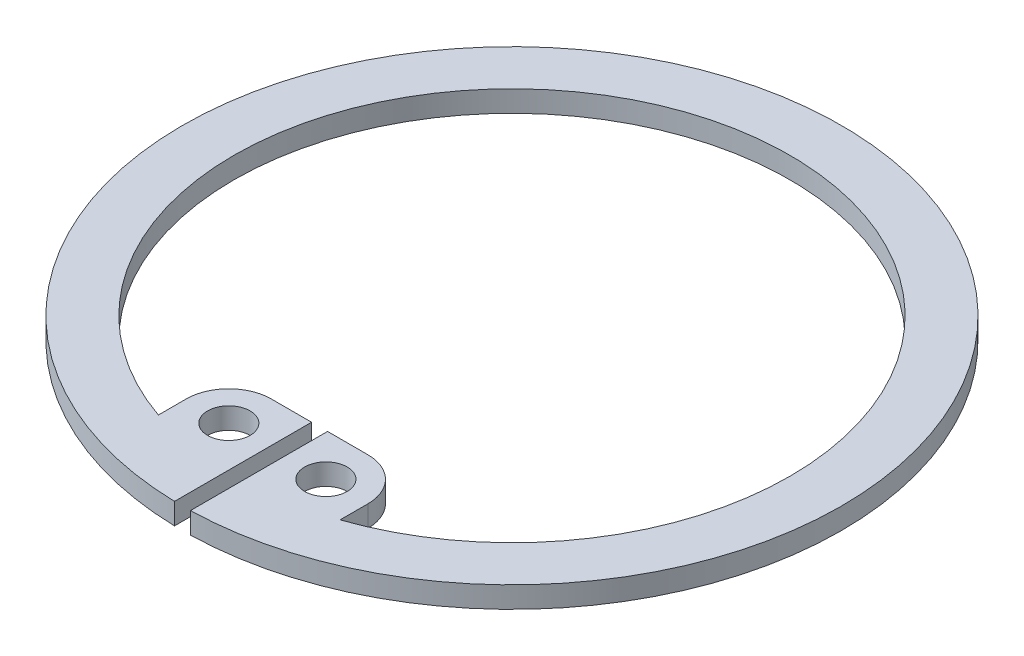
SolidWorks part; units mm, degrees
ref_plane "Plan de face" through (0, 0, 0) normal (0, 0, 1) x (1, 0, 0)
ref_plane "Plan de dessus" through (0, 0, 0) normal (0, 1, 0) x (1, 0, 0)
ref_plane "Plan de droite" through (0, 0, 0) normal (1, 0, 0) x (0, 0, -1)
sketch "Esquisse1" plane through (0, 0, 0) normal (0, 1, 0) x (1, 0, 0)
  line L0 (0, 72.325) -> (0, -82.8708) construction
  line L1 (-1.5, -61.9819) -> (-1.5, -36.193)
  line L2 (17.0868, -36.193) -> (1.5, -36.193)
  line L3 (-17.0868, -49.4301) -> (-17.0868, -36.193)
  line L4 (-17.0868, -36.193) -> (-1.5, -36.193)
  line L5 (17.0868, -49.4301) -> (17.0868, -36.193)
  line L6 (1.5, -61.9819) -> (1.5, -36.193)
  arc A0 (17.0868, -49.4301) -> (-17.0868, -49.4301) centre (0, 0) ccw
  arc A1 (1.5, -61.9819) -> (-1.5, -61.9819) centre (0, 0) ccw
  circle A2 centre (-9.1339, -44.1291) radius 4
  circle A3 centre (9.1339, -44.1291) radius 4
  dimension "D1" = 104.6
  dimension "D2" = 124
  dimension "D3" = 8
extrude "Extrusion2" add sketch "Esquisse1" along normal blind 4
fillet "Congé2" radius 8 2 edges at (17.0868, 2, 36.193) (-17.0868, 2, 36.193)
